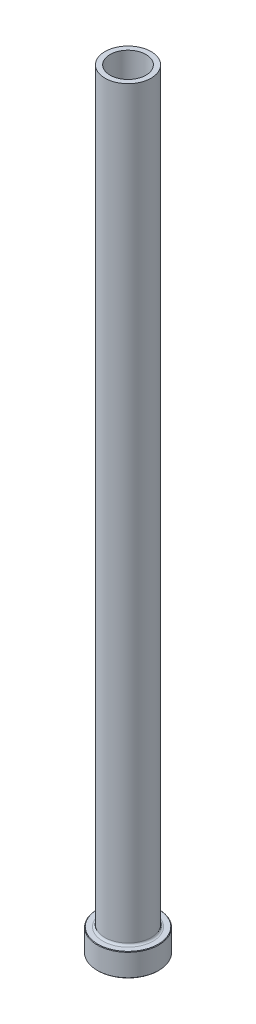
SolidWorks part; units mm, degrees
ref_plane "Front Plane" through (0, 0, 0) normal (0, 0, 1) x (1, 0, 0)
ref_plane "Top Plane" through (0, 0, 0) normal (0, 1, 0) x (1, 0, 0)
ref_plane "Right Plane" through (0, 0, 0) normal (1, 0, 0) x (0, 0, -1)
sketch "Sketch1" plane through (0, 0, 0) normal (0, 0, 1) x (1, 0, 0)
  line L0 (-7, 300) -> (-9, 300)
  line L1 (-9, 300) -> (-9, 9)
  line L2 (-9, 9) -> (-12, 9)
  line L3 (-12, 9) -> (-12, 0)
  line L4 (13.2, 0) -> (-13.2, 0) construction
  line L5 (-12, 0) -> (-7.25, 0)
  line L6 (-7, 245) -> (-7, 300)
  line L7 (0, 92.1877) -> (0, -15.5353) construction
  line L8 (0, -13.2) -> (0, 13.2) construction
  line L9 (-7, 245) -> (-7.25, 233)
  line L10 (-7.25, 233) -> (-7.25, 0)
  dimension "D1" = 0.25
  dimension "ID" = 14
  dimension "OD" = 18
  dimension "L" = 300
  dimension "H" = 24
  dimension "T" = 9
  dimension "N" = 55
  dimension "D2" = 12
revolve "Revolve1" add sketch "Sketch1" angle 360 about L7
fillet "Fillet1" radius 0.8 1 edges at (0, 9, 9)
chamfer "Chamfer1" distance 0.2 angle 45 2 edges at (0, 9, 12) (0, 0, 12)
chamfer "Chamfer3" distance 0.5 angle 45 1 edges at (0, 0, 7.25)
